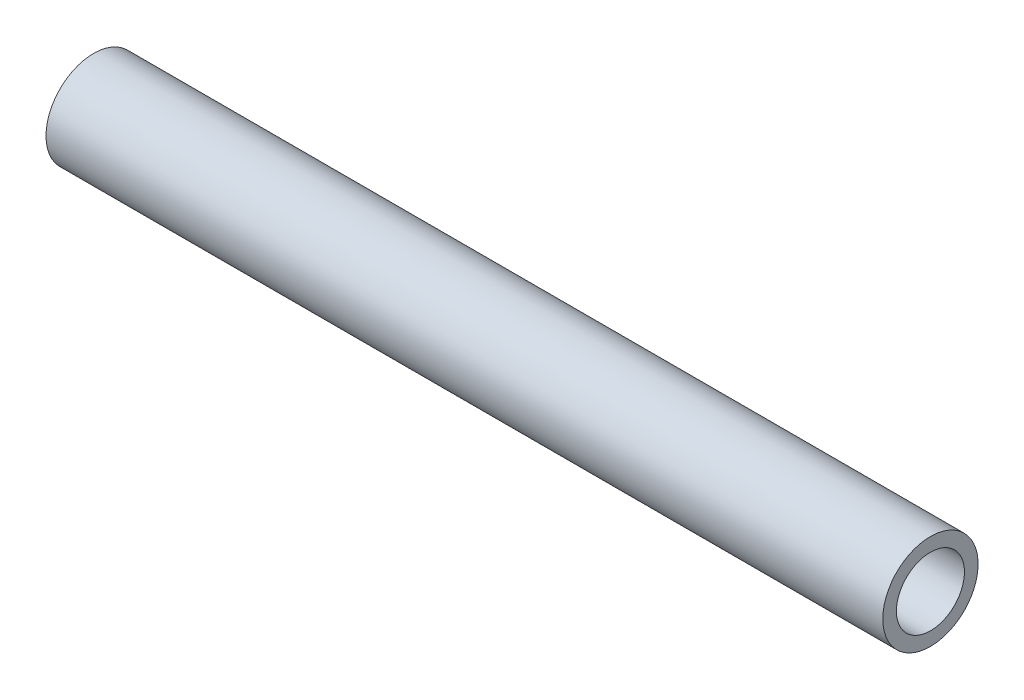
SolidWorks part; units mm, degrees
ref_plane "Front" through (0, 0, 0) normal (0, 0, 1) x (1, 0, 0)
ref_plane "Top" through (0, 0, 0) normal (0, 1, 0) x (1, 0, 0)
ref_plane "Right" through (0, 0, 0) normal (1, 0, 0) x (0, 0, -1)
sketch "Sketch1" plane through (0, 0, 0) normal (0, 0, 1) x (1, 0, 0)
  line L0 (0, 0) -> (187.325, 0)
  line L1 (9.9848, 0) -> (-9.9848, 0) construction
  dimension "D1" = 187.325
other "Structural Member1"
ref_plane "Plane1" through (0, 0, 0) normal (1, 0, 0) x (0, 0, -1)
sketch "Sketch11" plane through (0, 0, 0) normal (1, 0, 0) x (0, 0, -1)
  circle A0 centre (0, 0) radius 7.62
  circle A1 centre (0, 0) radius 10.668
  point P3 (0, 0)
  dimension "D1" = 21.336
  dimension "D2" = 15.24
